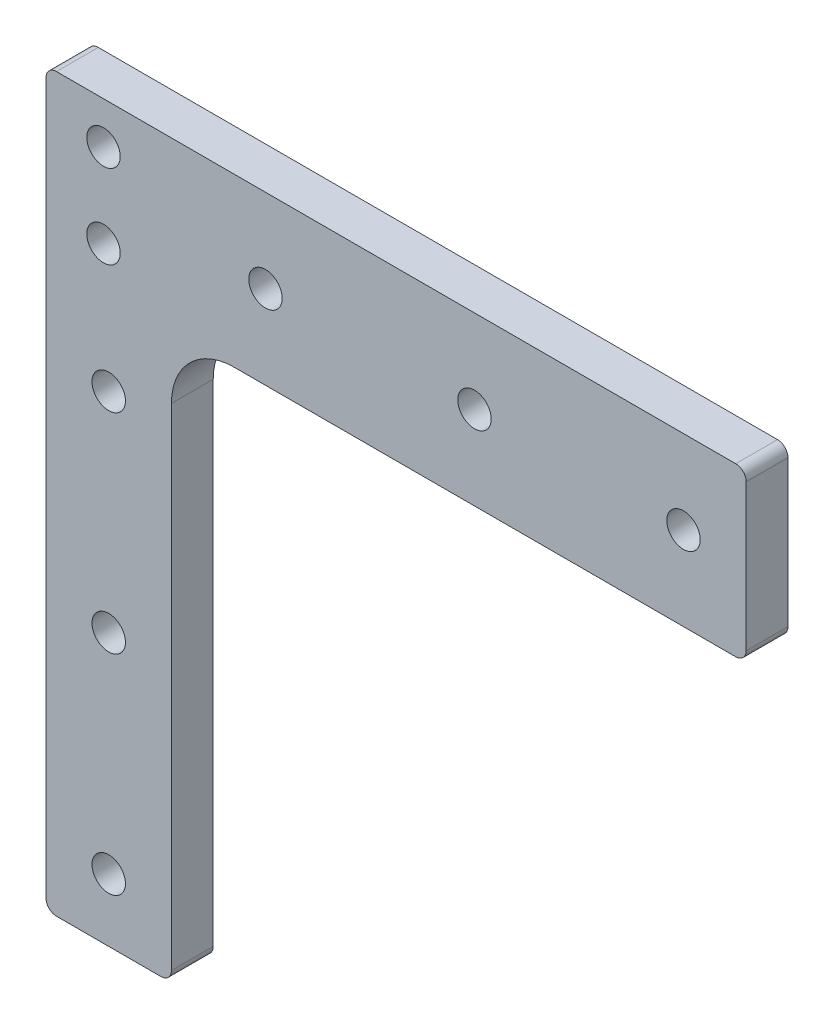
SolidWorks part; units mm, degrees
ref_plane "前视基准面" through (0, 0, 0) normal (0, 0, 1) x (1, 0, 0)
ref_plane "上视基准面" through (0, 0, 0) normal (0, 1, 0) x (1, 0, 0)
ref_plane "右视基准面" through (0, 0, 0) normal (1, 0, 0) x (0, 0, -1)
other "Configuration Table"
sketch "草图1" plane through (0, 0, 0) normal (0, 0, 1) x (1, 0, 0)
  line L0 (0, 0) -> (20, 0) construction
  line L1 (46, 8) -> (-21, 8)
  line L2 (-21, 8) -> (-21, -62)
  line L3 (-21, -62) -> (-9, -62)
  line L4 (-9, -62) -> (-9, -8)
  line L5 (-9, -8) -> (46, -8)
  line L6 (-15, -56) -> (-15, -36) construction
  line L7 (46, 8) -> (46, -8)
  circle A0 centre (0, 0) radius 1.6
  circle A1 centre (20, 0) radius 1.6
  circle A2 centre (40, 0) radius 1.6
  circle A8 centre (-15.5, -4) radius 1.6
  circle A9 centre (-15.5, 4) radius 1.6
  circle A10 centre (-15, -56) radius 1.6
  circle A11 centre (-15, -36) radius 1.6
  circle A12 centre (-15, -16) radius 1.6
  dimension "D3" = 3.2
  dimension "D4" = 8
  dimension "D10" = 3.2
  dimension "D8" = 8
  dimension "D15" = 3.2
  dimension "D1" = 20
  dimension "D5" = 12
  dimension "D6" = 9
  dimension "D7" = 70
  dimension "D9" = 4
  dimension "D11" = 6.5
  dimension "D13" = 20
  dimension "D14" = 6
  dimension "D16" = 6
  dimension "D17" = 8
  dimension "D18" = 6
  dimension "D2" = 3
  dimension "D12" = 3
extrude "凸台-拉伸1" add sketch "草图1" along normal blind 4
fillet "圆角1" radius 6 1 edges at (-9, -8, 2)
fillet "圆角2" radius 1 5 edges at (-21, 8, 2) (-21, -62, 2) (-9, -62, 2) (46, -8, 2) (46, 8, 2)
